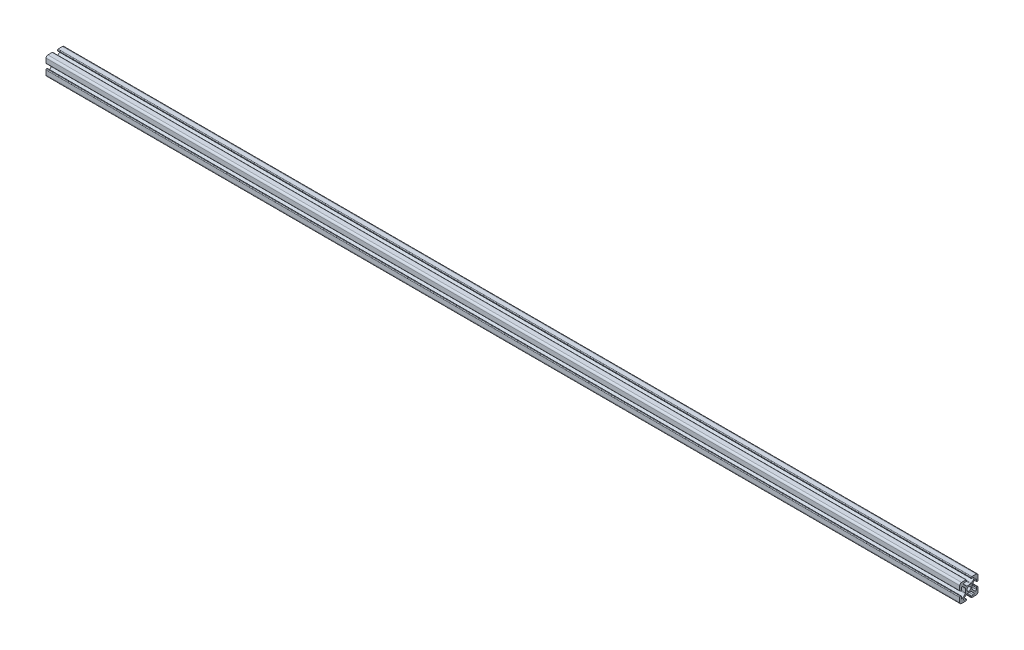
SolidWorks part; units mm, degrees
ref_plane "Ebene vorne" through (0, 0, 0) normal (0, 0, 1) x (1, 0, 0)
ref_plane "Ebene oben" through (0, 0, 0) normal (0, 1, 0) x (1, 0, 0)
ref_plane "Ebene rechts" through (0, 0, 0) normal (1, 0, 0) x (0, 0, -1)
sketch "Skizze1" plane through (0, 0, 0) normal (0, 1, 0) x (1, 0, 0)
  line L0 (0, 0) -> (1000, 0)
  dimension "D1" = 1000
other "Strukturbauteil1"
ref_plane "Ebene1" through (0, 0, 0) normal (1, 0, 0) x (0, 0, -1)
sketch "Model" plane through (0, 0, 0) normal (1, 0, 0) x (0, 0, -1)
  line L0 (-8.7, -2.5) -> (-9.3, -2.5)
  line L1 (-10, -3.2) -> (-10, -8)
  line L2 (-8, -10) -> (-3.2, -10)
  line L3 (-2.5, -9.3) -> (-2.5, -8.7)
  line L4 (-3, -8.2) -> (-4.8676, -8.2)
  line L5 (-5.4915, -6.6936) -> (-2.7408, -3.9429)
  line L6 (-2.0337, -3.65) -> (2.0337, -3.65)
  line L7 (2.7408, -3.9429) -> (5.4915, -6.6936)
  line L8 (4.8676, -8.2) -> (3, -8.2)
  line L9 (2.5, -8.7) -> (2.5, -9.3)
  line L10 (3.2, -10) -> (8, -10)
  line L11 (10, -8) -> (10, -3.2)
  line L12 (9.3, -2.5) -> (8.7, -2.5)
  line L13 (8.2, -3) -> (8.2, -4.8676)
  line L14 (6.6936, -5.4915) -> (3.9429, -2.7408)
  line L15 (3.65, -2.0337) -> (3.65, 2.0337)
  line L16 (3.9429, 2.7408) -> (6.6936, 5.4915)
  line L17 (8.2, 4.8676) -> (8.2, 3)
  line L18 (8.7, 2.5) -> (9.3, 2.5)
  line L19 (10, 3.2) -> (10, 8)
  line L20 (8, 10) -> (3.2, 10)
  line L21 (2.5, 9.3) -> (2.5, 8.7)
  line L22 (3, 8.2) -> (4.8676, 8.2)
  line L23 (5.4915, 6.6936) -> (2.7408, 3.9429)
  line L24 (2.0337, 3.65) -> (-2.0337, 3.65)
  line L25 (-2.7408, 3.9429) -> (-5.4915, 6.6936)
  line L26 (-4.8676, 8.2) -> (-3, 8.2)
  line L27 (-2.5, 8.7) -> (-2.5, 9.3)
  line L28 (-3.2, 10) -> (-8, 10)
  line L29 (-10, 8) -> (-10, 3.2)
  line L30 (-9.3, 2.5) -> (-8.7, 2.5)
  line L31 (-8.2, 3) -> (-8.2, 4.8676)
  line L32 (-6.6936, 5.4915) -> (-3.9429, 2.7408)
  line L33 (-3.65, 2.0337) -> (-3.65, -2.0337)
  line L34 (-3.9429, -2.7408) -> (-6.6936, -5.4915)
  line L35 (-8.2, -4.8676) -> (-8.2, -3)
  line L37 (-10, -10) -> (10, -10) construction
  line L38 (-10, -10) -> (-10, 10) construction
  line L39 (-10, 10) -> (10, 10) construction
  line L40 (10, -10) -> (10, 10) construction
  line L41 (-10, -10) -> (10, 10) construction
  line L42 (-10, 10) -> (10, -10) construction
  circle A0 centre (0, 0) radius 2.15
  arc A1 (-8.2, -3) -> (-8.7, -2.5) centre (-8.7, -3) ccw
  arc A2 (-9.3, -2.5) -> (-10, -3.2) centre (-9.3, -3.2) ccw
  arc A3 (-10, -8) -> (-8, -10) centre (-8, -8) ccw
  arc A4 (-3.2, -10) -> (-2.5, -9.3) centre (-3.2, -9.3) ccw
  arc A5 (-2.5, -8.7) -> (-3, -8.2) centre (-3, -8.7) ccw
  arc A6 (-5.4915, -6.6936) -> (-4.8676, -8.2) centre (-4.8676, -7.3176) ccw
  arc A7 (-2.0337, -3.65) -> (-2.7408, -3.9429) centre (-2.0337, -4.65) ccw
  arc A8 (2.7408, -3.9429) -> (2.0337, -3.65) centre (2.0337, -4.65) ccw
  arc A9 (4.8676, -8.2) -> (5.4915, -6.6936) centre (4.8676, -7.3176) ccw
  arc A10 (3, -8.2) -> (2.5, -8.7) centre (3, -8.7) ccw
  arc A11 (2.5, -9.3) -> (3.2, -10) centre (3.2, -9.3) ccw
  arc A12 (8, -10) -> (10, -8) centre (8, -8) ccw
  arc A13 (10, -3.2) -> (9.3, -2.5) centre (9.3, -3.2) ccw
  arc A14 (8.7, -2.5) -> (8.2, -3) centre (8.7, -3) ccw
  arc A15 (6.6936, -5.4915) -> (8.2, -4.8676) centre (7.3176, -4.8676) ccw
  arc A16 (3.65, -2.0337) -> (3.9429, -2.7408) centre (4.65, -2.0337) ccw
  arc A17 (3.9429, 2.7408) -> (3.65, 2.0337) centre (4.65, 2.0337) ccw
  arc A18 (8.2, 4.8676) -> (6.6936, 5.4915) centre (7.3176, 4.8676) ccw
  arc A19 (8.2, 3) -> (8.7, 2.5) centre (8.7, 3) ccw
  arc A20 (9.3, 2.5) -> (10, 3.2) centre (9.3, 3.2) ccw
  arc A21 (10, 8) -> (8, 10) centre (8, 8) ccw
  arc A22 (3.2, 10) -> (2.5, 9.3) centre (3.2, 9.3) ccw
  arc A23 (2.5, 8.7) -> (3, 8.2) centre (3, 8.7) ccw
  arc A24 (5.4915, 6.6936) -> (4.8676, 8.2) centre (4.8676, 7.3176) ccw
  arc A25 (2.0337, 3.65) -> (2.7408, 3.9429) centre (2.0337, 4.65) ccw
  arc A26 (-2.7408, 3.9429) -> (-2.0337, 3.65) centre (-2.0337, 4.65) ccw
  arc A27 (-4.8676, 8.2) -> (-5.4915, 6.6936) centre (-4.8676, 7.3176) ccw
  arc A28 (-3, 8.2) -> (-2.5, 8.7) centre (-3, 8.7) ccw
  arc A29 (-2.5, 9.3) -> (-3.2, 10) centre (-3.2, 9.3) ccw
  arc A30 (-8, 10) -> (-10, 8) centre (-8, 8) ccw
  arc A31 (-10, 3.2) -> (-9.3, 2.5) centre (-9.3, 3.2) ccw
  arc A32 (-8.7, 2.5) -> (-8.2, 3) centre (-8.7, 3) ccw
  arc A33 (-6.6936, 5.4915) -> (-8.2, 4.8676) centre (-7.3176, 4.8676) ccw
  arc A34 (-3.65, 2.0337) -> (-3.9429, 2.7408) centre (-4.65, 2.0337) ccw
  arc A35 (-3.9429, -2.7408) -> (-3.65, -2.0337) centre (-4.65, -2.0337) ccw
  arc A36 (-8.2, -4.8676) -> (-6.6936, -5.4915) centre (-7.3176, -4.8676) ccw
  point P114 (-10, 0)
  point P115 (0, 10)
  point P116 (10, 0)
  point P117 (0, -10)
  point P118 (0, 0)
